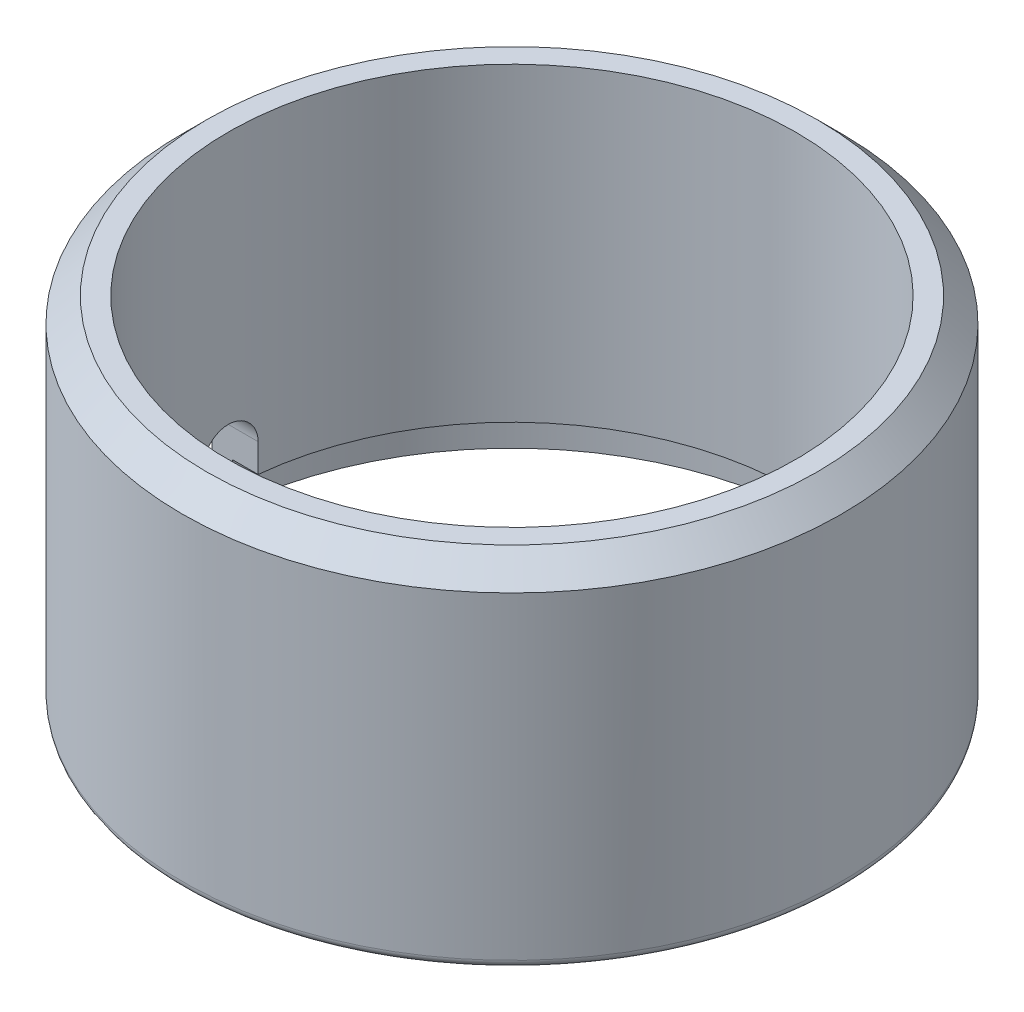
SolidWorks part; units mm, degrees
ref_plane "Front Plane" through (0, 0, 0) normal (0, 0, 1) x (1, 0, 0)
ref_plane "Top Plane" through (0, 0, 0) normal (0, 1, 0) x (1, 0, 0)
ref_plane "Right Plane" through (0, 0, 0) normal (1, 0, 0) x (0, 0, -1)
sketch "Sketch1" plane through (0, 0, 0) normal (0, 1, 0) x (1, 0, 0)
  circle A0 centre (0, 0) radius 20.3
  dimension "D1" = 40.6
extrude "Boss-Extrude1" add sketch "Sketch1" along normal blind 21.6
sketch "Sketch3" plane through (0, 0, 0) normal (0, -1, 0) x (1, 0, 0)
  circle A0 centre (0, 0) radius 17.475
  dimension "D1" = 34.95
extrude "Cut-Extrude1" cut sketch "Sketch3" against normal through all
chamfer "Chamfer1" distance 1.5 angle 45 1 edges at (0, 21.6, 20.3)
sketch "Sketch4" plane through (0, 0, 0) normal (0, -1, 0) x (1, 0, 0)
  circle A0 centre (0, 0) radius 19.05
  dimension "D1" = 38.1
extrude "Cut-Extrude2" cut sketch "Sketch4" against normal blind 2.5
fillet "Fillet1" radius 0.5 1 edges at (0, 0, 20.3)
ref_plane "Plane1" through (-20.3, 0, 0) normal (-1, 0, 0) x (0, 0, 1)
sketch "Sketch8" plane through (-20.3, 0, 0) normal (-1, 0, 0) x (0, 0, 1)
  line L1 (1.75, 0) -> (-1.75, 0)
  line L2 (1.75, 0) -> (1.75, 4.255)
  line L3 (0.005, 6) -> (0, 6)
  line L4 (-1.75, 0) -> (-1.75, 4.25)
  arc A0 (0, 6) -> (-1.75, 4.25) centre (0, 4.25) ccw
  arc A1 (1.75, 4.255) -> (0.005, 6) centre (0.005, 4.255) ccw
  point P7 (-1.75, 6)
  point P10 (1.75, 6)
  dimension "D3" = 1.75
  dimension "D4" = 1.745
  dimension "D1" = 3.5
  dimension "D2" = 6
extrude "Cut-Extrude4" cut sketch "Sketch8" against normal up to next
